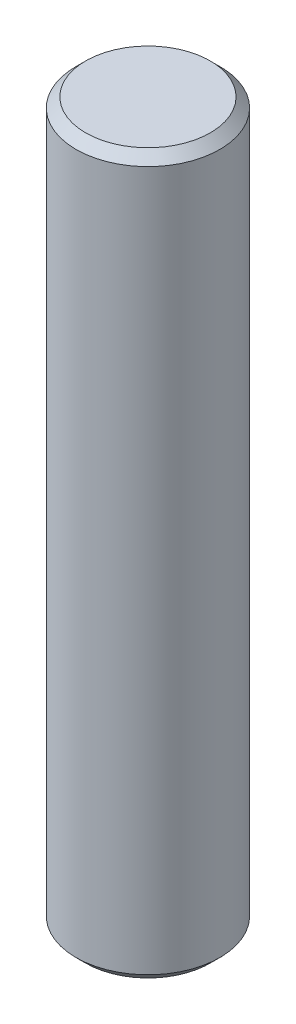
SolidWorks part; units mm, degrees
ref_plane "Front Plane" through (0, 0, 0) normal (0, 0, 1) x (1, 0, 0)
ref_plane "Top Plane" through (0, 0, 0) normal (0, 1, 0) x (1, 0, 0)
ref_plane "Right Plane" through (0, 0, 0) normal (1, 0, 0) x (0, 0, -1)
sketch "Sketch1" plane through (0, 0, 0) normal (0, 1, 0) x (1, 0, 0)
  circle A0 centre (0, 0) radius 1.5
  dimension "D1" = 3
extrude "Boss-Extrude1" add sketch "Sketch1" along normal blind 15
chamfer "Chamfer1" distance 0.2 angle 45 2 edges at (0, 0, 1.5) (0, 15, 1.5)
